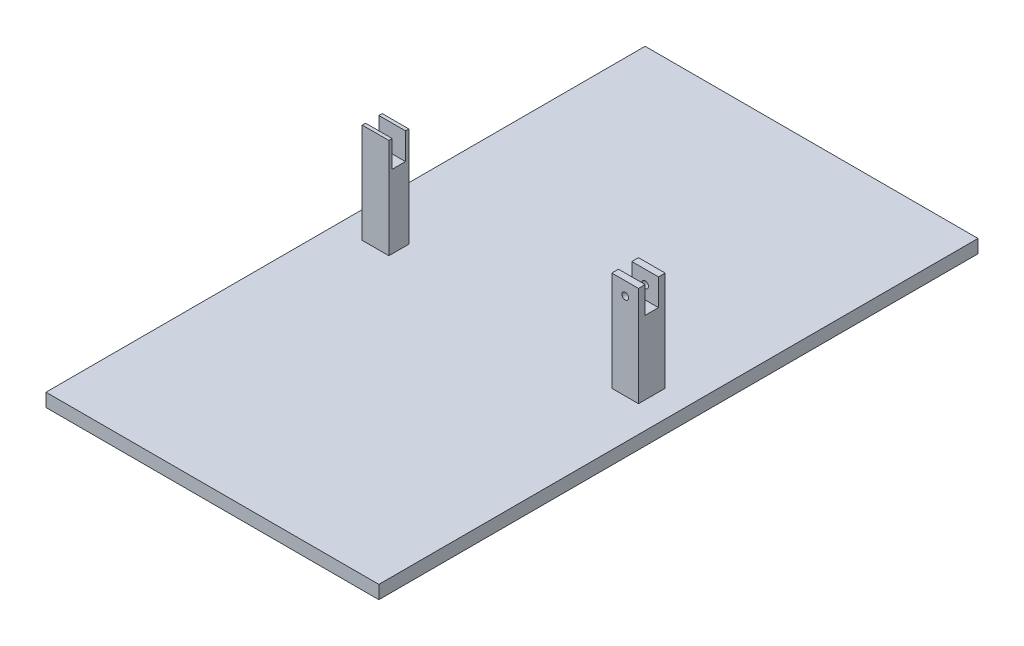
SolidWorks part; units mm, degrees
ref_plane "Plan de face" through (0, 0, 0) normal (0, 0, 1) x (1, 0, 0)
ref_plane "Plan de dessus" through (0, 0, 0) normal (0, 1, 0) x (1, 0, 0)
ref_plane "Plan de droite" through (0, 0, 0) normal (1, 0, 0) x (0, 0, -1)
sketch "Esquisse1" plane through (0, 0, 0) normal (0, 1, 0) x (1, 0, 0)
  line L1 (-25, 45) -> (25, 45)
  line L2 (-25, 45) -> (-25, -45)
  line L3 (-25, -45) -> (25, -45)
  line L4 (25, 45) -> (25, -45)
  dimension "D1" = 50
  dimension "D2" = 90
extrude "Boss.-Extru.1" add sketch "Esquisse1" along normal blind 2
sketch "Esquisse2" plane through (0, 2, 0) normal (0, 1, 0) x (1, 0, 0)
  line L1 (17, 2) -> (21, 2)
  line L2 (17, 2) -> (17, -2)
  line L3 (17, -2) -> (21, -2)
  line L4 (21, 2) -> (21, -2)
  line L5 (-21, 1.5) -> (-17, 1.5)
  line L6 (-21, 1.5) -> (-21, -1.5)
  line L7 (-21, -1.5) -> (-17, -1.5)
  line L8 (-17, 1.5) -> (-17, -1.5)
  dimension "D1" = 4
  dimension "D2" = 4
  dimension "D3" = 4
  dimension "D4" = 3
  dimension "D5" = 17
  dimension "D6" = 17
  dimension "D7" = 2
  dimension "D8" = 1.5
extrude "Boss.-Extru.2" add sketch "Esquisse2" along normal blind 15
sketch "Esquisse3" plane through (21, 0, 0) normal (1, 0, 0) x (0, 0, -1)
  line L0 (-2, 17) -> (2, 17) construction
  line L1 (-1, 17) -> (1, 17)
  line L2 (-1, 17) -> (-1, 13)
  line L3 (-1, 13) -> (1, 13)
  line L4 (1, 17) -> (1, 13)
  dimension "D1" = 2
  dimension "D2" = 4
extrude "Enlèv. mat.-Extru.1" cut sketch "Esquisse3" against normal through all
sketch "Esquisse4" plane through (0, 0, 2) normal (0, 0, 1) x (1, 0, 0)
  line L0 (21, 17) -> (21, 2) construction
  line L1 (17, 17) -> (21, 17) construction
  circle A0 centre (19, 15) radius 0.5
  dimension "D1" = 2
  dimension "D2" = 2
extrude "Enlèv. mat.-Extru.2" cut sketch "Esquisse4" against normal through all
